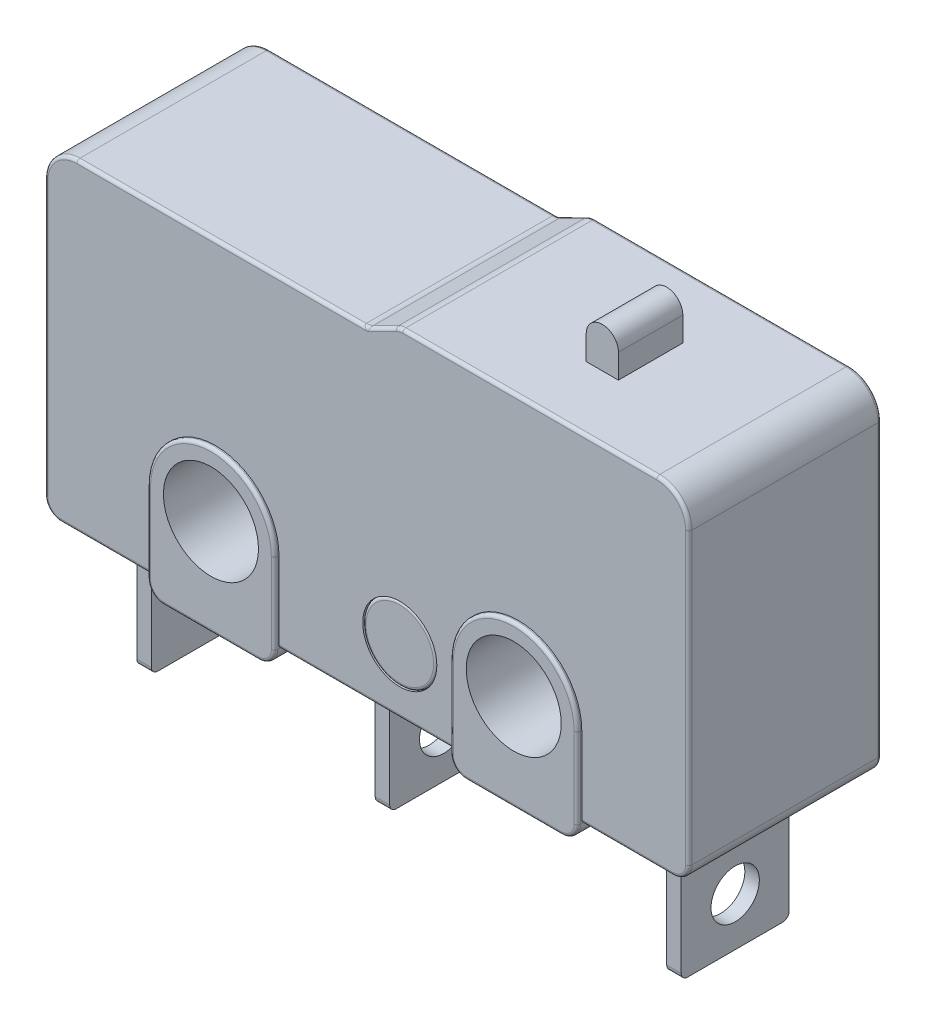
SolidWorks part; units mm, degrees
ref_plane "Plano frontal" through (0, 0, 0) normal (0, 0, 1) x (1, 0, 0)
ref_plane "Plano superior" through (0, 0, 0) normal (0, 1, 0) x (1, 0, 0)
ref_plane "Plano direito" through (0, 0, 0) normal (1, 0, 0) x (0, 0, -1)
sketch "Esboço1" plane through (0, 0, 0) normal (0, 0, 1) x (1, 0, 0)
  line L0 (-9, -0.5) -> (0, -0.5)
  line L1 (-9.5, -10.5) -> (9.5, -10.5)
  line L2 (-10, -10) -> (-10, -1) construction
  line L3 (-9, 0) -> (9, 0) construction
  line L4 (10, -10) -> (10, -1)
  line L5 (0, -0.5) -> (1, 0)
  line L6 (-10, -10) -> (-10, -1.5)
  line L7 (1, 0) -> (9, 0)
  arc A0 (9, 0) -> (10, -1) centre (9, -1) cw
  arc A1 (-10, -1) -> (-9, 0) centre (-9, -1) cw construction
  arc A2 (9.5, -10.5) -> (10, -10) centre (9.5, -10) ccw
  arc A3 (-9.5, -10.5) -> (-10, -10) centre (-9.5, -10) cw
  arc A4 (-9, -0.5) -> (-10, -1.5) centre (-9, -1.5) ccw
  point P4 (0, 0)
  point P10 (-10, 0)
  point P13 (10, -10.5)
  point P16 (-10, -10.5)
  dimension "D3" = 1
  dimension "D4" = 0.5
  dimension "D5" = 1
  dimension "D1" = 10.5
  dimension "D2" = 20
  dimension "D6" = 0.5
  dimension "D7" = 10
  dimension "D8" = 1
extrude "Ressalto-extrusão1" add sketch "Esboço1" against normal mid plane 5.975
sketch "Esboço2" plane through (0, 0, 2.9875) normal (0, 0, 1) x (1, 0, 0)
  line L0 (-6.675, -10.5) -> (-6.675, -8)
  line L1 (-2.725, -8) -> (-2.725, -10.5)
  line L2 (-3.225, -11) -> (-6.175, -11)
  line L3 (-9.5, -10.5) -> (9.5, -10.5) construction
  line L7 (0, -10.5) -> (0, 0) construction
  line L8 (3.225, -11) -> (6.175, -11)
  line L9 (2.725, -8) -> (2.725, -10.5)
  line L10 (6.675, -10.5) -> (6.675, -8)
  arc A0 (-6.675, -8) -> (-2.725, -8) centre (-4.7, -8) cw
  arc A1 (-2.725, -10.5) -> (-3.225, -11) centre (-3.225, -10.5) cw
  arc A2 (-6.675, -10.5) -> (-6.175, -11) centre (-6.175, -10.5) ccw
  circle A3 centre (-4.7, -8) radius 1.475 construction
  circle A4 centre (4.7, -8) radius 1.475 construction
  arc A5 (6.675, -10.5) -> (6.175, -11) centre (6.175, -10.5) cw
  arc A6 (2.725, -10.5) -> (3.225, -11) centre (3.225, -10.5) ccw
  arc A7 (6.675, -8) -> (2.725, -8) centre (4.7, -8) ccw
  dimension "D1" = 0.5
  dimension "D2" = 1.975
  dimension "D4" = 2.95
  dimension "D5" = 9.4
  dimension "D3" = 2.5
extrude "Ressalto-extrusão2" add sketch "Esboço2" along normal blind 0.1375 separate body
mirror "Espelhar1" about plane through (0, 0, 0) normal (0, 0, 1)
combine bodies "Combinar1" operation type add bodies to combine 102 103 101 104 105
sketch "Esboço3" plane through (0, 0, 2.9875) normal (0, 0, -1) x (-1, 0, 0)
  line L0 (6.175, -11) -> (3.225, -11) construction
  line L1 (-3.225, -11) -> (-6.175, -11) construction
  line L2 (6.175, -11) -> (3.225, -11)
  line L3 (-3.225, -11) -> (-6.175, -11)
  line L4 (-6.675, -10.5) -> (-2.725, -10.5)
  line L5 (2.725, -10.5) -> (6.675, -10.5)
  arc A0 (2.725, -10.5) -> (3.225, -11) centre (3.225, -10.5) ccw construction
  arc A1 (6.175, -11) -> (6.675, -10.5) centre (6.175, -10.5) ccw construction
  arc A2 (-6.675, -10.5) -> (-6.175, -11) centre (-6.175, -10.5) ccw construction
  arc A3 (-3.225, -11) -> (-2.725, -10.5) centre (-3.225, -10.5) ccw construction
  arc A4 (2.725, -10.5) -> (3.225, -11) centre (3.225, -10.5) ccw
  arc A5 (6.175, -11) -> (6.675, -10.5) centre (6.175, -10.5) ccw
  arc A6 (-6.675, -10.5) -> (-6.175, -11) centre (-6.175, -10.5) ccw
  arc A7 (-3.225, -11) -> (-2.725, -10.5) centre (-3.225, -10.5) ccw
extrude "Ressalto-extrusão3" add sketch "Esboço3" along normal up to next
fillet "Filete1" radius 0.1 48 edges at (-6.675, -9.25, -3.125) (-6.5286, -10.8536, -3.125) (-4.7, -11, -3.125) (-2.8714, -10.8536, -3.125) (-2.725, -9.25, -3.125) (-4.7, -6.025, -3.125) (6.675, -9.25, -3.125) (4.7, -6.025, -3.125) (2.725, -9.25, -3.125) (2.8714, -10.8536, -3.125) (4.7, -11, -3.125) (6.5286, -10.8536, -3.125) (4.7, -11, 3.125) (2.8714, -10.8536, 3.125) (2.725, -9.25, 3.125) (4.7, -6.025, 3.125) (6.675, -9.25, 3.125) (6.5286, -10.8536, 3.125) (-2.725, -9.25, 3.125) (-2.8714, -10.8536, 3.125) (-4.7, -11, 3.125) (-6.5286, -10.8536, 3.125) (-6.675, -9.25, 3.125) (-4.7, -6.025, 3.125) (-9.8536, -10.3536, -2.9875) (9.7071, -0.2929, -2.9875) (10, -5.5, -2.9875) (9.8536, -10.3536, -2.9875) (9.8536, -10.3536, 2.9875) (10, -5.5, 2.9875) (9.7071, -0.2929, 2.9875) (-9.8536, -10.3536, 2.9875) (-8.0875, -10.5, -2.9875) (0, -10.5, -2.9875) (8.0875, -10.5, -2.9875) (8.0875, -10.5, 2.9875) (0, -10.5, 2.9875) (-8.0875, -10.5, 2.9875) (-4.5, -0.5, -2.9875) (-9.7071, -0.7929, -2.9875) (-10, -5.75, -2.9875) (5, 0, -2.9875) (5, 0, 2.9875) (-4.5, -0.5, 2.9875) (-9.7071, -0.7929, 2.9875) (-10, -5.75, 2.9875) (0.5, -0.25, -2.9875) (0.5, -0.25, 2.9875)
sketch "Esboço4" plane through (0, 0, 3.125) normal (0, 0, 1) x (1, 0, 0)
  line L0 (0, -10.5) -> (0, 0) construction
  line L1 (2.725, -10.5) -> (-2.725, -10.5) construction
  circle A0 centre (-4.7, -8) radius 1.475
  circle A1 centre (4.7, -8) radius 1.475
  dimension "D1" = 2.95
extrude "Corte-extrusão3" cut sketch "Esboço4" against normal through all
fillet "Filete2" radius 0.5 6 edges at (1.0069, -0.0293, 2.9582) (1.0069, -0.0293, -2.9582) (0.0069, -0.5293, -2.9582) (0.0069, -0.5293, 2.9582) (1, 0, 0) (0, -0.5, 0)
sketch "Esboço5" plane through (0, -10.5, 0) normal (0, -1, 0) x (1, 0, 0)
  line L0 (-10, 0) -> (10, 0) construction
  line L1 (-10, -2.8875) -> (-10, 2.8875) construction
  line L2 (10, -2.8875) -> (10, 2.8875) construction
  line L4 (-8.45, -1.675) -> (-8, -1.675)
  line L5 (-8.45, -1.675) -> (-8.45, 1.675)
  line L6 (-8.45, 1.675) -> (-8, 1.675)
  line L7 (-8, -1.675) -> (-8, 1.675)
  line L8 (-8.45, -1.675) -> (-8, 1.675) construction
  line L9 (-8.45, 1.675) -> (-8, -1.675) construction
  line L10 (-1.05, -1.675) -> (-0.6, -1.675)
  line L11 (-1.05, -1.675) -> (-1.05, 1.675)
  line L12 (-1.05, 1.675) -> (-0.6, 1.675)
  line L13 (-0.6, -1.675) -> (-0.6, 1.675)
  line L14 (-1.05, -1.675) -> (-0.6, 1.675) construction
  line L15 (-1.05, 1.675) -> (-0.6, -1.675) construction
  line L16 (8, -1.675) -> (8.45, -1.675)
  line L17 (8, -1.675) -> (8, 1.675)
  line L18 (8, 1.675) -> (8.45, 1.675)
  line L19 (8.45, -1.675) -> (8.45, 1.675)
  line L20 (8, -1.675) -> (8.45, 1.675) construction
  line L21 (8, 1.675) -> (8.45, -1.675) construction
  point P6 (-8.225, 0)
  point P11 (-0.825, 0)
  point P16 (8.225, 0)
  dimension "D1" = 3.35
  dimension "D2" = 1.55
  dimension "D3" = 6.95
  dimension "D4" = 0.45
  dimension "D5" = 1.55
extrude "Ressalto-extrusão4" add sketch "Esboço5" along normal blind 4 separate body
sketch "Esboço6" plane through (-8.45, 0, 0) normal (-1, 0, 0) x (0, 0, 1)
  line L1 (1.675, -14.5) -> (-1.675, -14.5) construction
  circle A0 centre (0, -13) radius 0.75
  dimension "D1" = 1.5
  dimension "D2" = 1.5
extrude "Corte-extrusão4" cut sketch "Esboço6" against normal through all
fillet "Filete3" radius 0.2 2 edges at (-8.225, -14.5, -1.675) (-8.225, -14.5, 1.675)
fillet "Filete4" radius 0.2 2 edges at (-0.825, -14.5, 1.675) (-0.825, -14.5, -1.675)
fillet "Filete5" radius 0.2 2 edges at (8.225, -14.5, 1.675) (8.225, -14.5, -1.675)
sketch "Esboço20" plane through (0, 0, 0) normal (0, 0, 1) x (1, 0, 0)
  line L0 (4.825, 0.75) -> (4.825, 0)
  line L1 (4.825, 0) -> (5.825, 0)
  line L2 (1.118, 0) -> (9, 0) construction
  line L3 (5.825, 0) -> (5.825, 0.75)
  line L6 (10, -1) -> (10, -10) construction
  arc A0 (4.825, 0.75) -> (5.825, 0.75) centre (5.325, 0.75) cw
  dimension "D1" = 1
  dimension "D2" = 0.75
  dimension "D3" = 4.675
extrude "Ressalto-extrusão11" add sketch "Esboço20" along normal mid plane 2 separate body
sketch "Esboço17" plane through (0, 0, 2.9875) normal (0, 0, 1) x (1, 0, 0)
  line L0 (2.725, -10.5) -> (-2.725, -10.5) construction
  line L1 (2.725, -10.5) -> (2.725, -8) construction
  circle A0 centre (1.025, -8.5) radius 1.15
  dimension "D1" = 2.3
  dimension "D2" = 2
  dimension "D3" = 1.7
extrude "Corte-extrusão10" cut sketch "Esboço17" against normal through all
sketch "Esboço18" plane through (0, 0, 2.9875) normal (0, 0, 1) x (1, 0, 0)
  circle A0 centre (1.025, -8.5) radius 1.15
  circle A1 centre (1.025, -8.5) radius 1.15 construction
extrude "Ressalto-extrusão10" add sketch "Esboço18" against normal up to surface (5.975 mm away) separate body
fillet "Filete8" radius 0.1 2 edges at (-0.125, -8.5, -2.9875) (2.175, -8.5, 2.9875)
